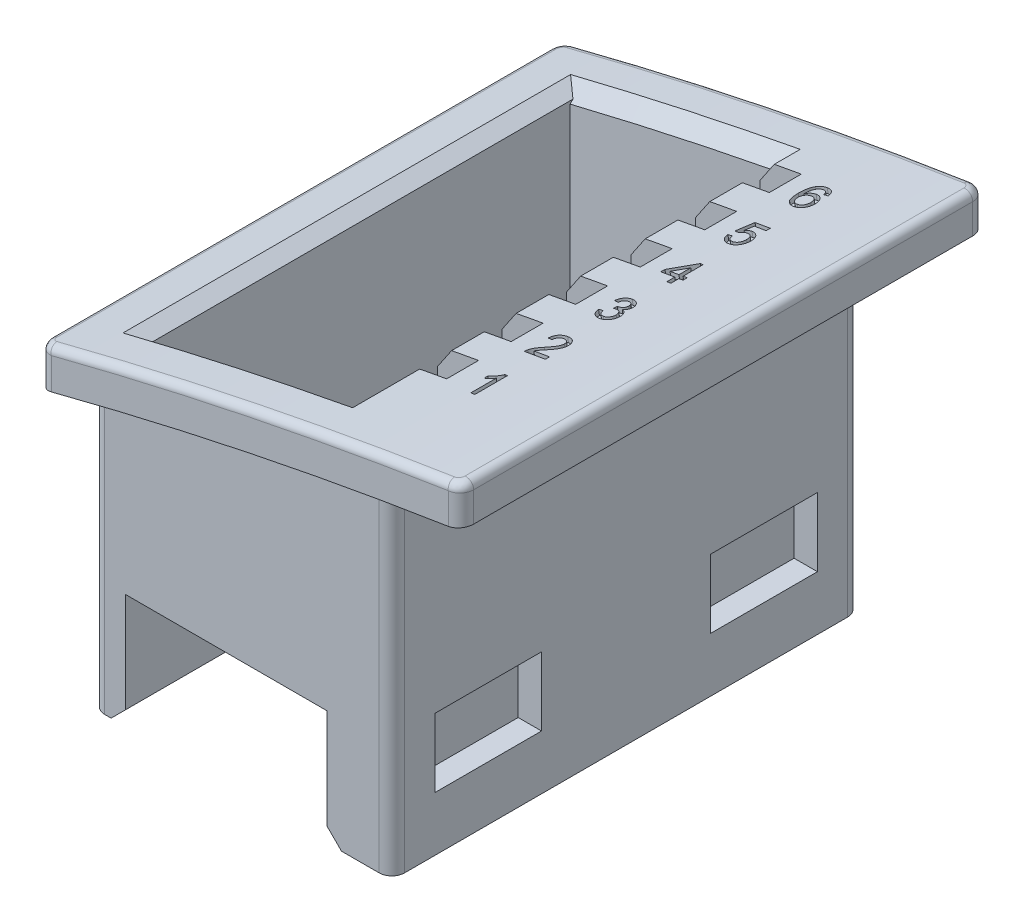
SolidWorks part; units mm, degrees
ref_plane "Front Plane" through (0, 0, 0) normal (0, 0, 1) x (1, 0, 0)
ref_plane "Top Plane" through (0, 0, 0) normal (0, 1, 0) x (1, 0, 0)
ref_plane "Right Plane" through (0, 0, 0) normal (1, 0, 0) x (0, 0, -1)
sketch "Sketch1" plane through (0, 0, 0) normal (0, 0, 1) x (1, 0, 0)
  line L0 (9.7211, 14.3502) -> (9.7193, 15.867)
  line L1 (-6.9049, 10.9118) -> (-6.9049, 12.4622)
  line L2 (6.8, 0) -> (-6.8, 0) construction
  line L3 (1.3625, 12.8514) -> (1.3625, 14.3829) construction
  arc A0 (9.7211, 14.3502) -> (-6.9049, 10.9118) centre (33.7964, -143.9799) ccw
  arc A3 (9.7193, 15.867) -> (-6.9049, 12.4622) centre (33.7964, -143.9799) ccw
  dimension "D1" = 160.15
  dimension "D3" = 161.65
  dimension "D2" = 12.8514
  dimension "D4" = 1.5168
  dimension "D5" = 1.5504
  dimension "D6" = 1.3625
extrude "Extrude1" add sketch "Sketch1" along normal mid plane 20.64
sketch "Sketch2" plane through (0, 0, 0) normal (0, 1, 0) x (1, 0, 0)
  line L0 (-5.9, -9.22) -> (5.9, -9.22)
  line L1 (5.9, 9.22) -> (5.9, -9.22)
  line L2 (5.9, 9.22) -> (-5.9, 9.22)
  line L3 (-5.9, 9.22) -> (-5.9, -9.22)
  line L4 (-5.9, 0) -> (5.9, 0) construction
  dimension "D1" = 11.8
  dimension "D2" = 18.44
extrude "Extrude2" add sketch "Sketch2" along normal up to surface (13.7218 mm away)
sketch "Sketch3" plane through (0, 0, 9.22) normal (0, 0, 1) x (1, 0, 0)
  line L0 (-5.9, 10.9118) -> (-6.9049, 10.9118)
  line L1 (-5.9, 11.1724) -> (-5.9, 0) construction
  line L2 (-5.9, 10.9118) -> (-5.9, 11.3118)
  line L3 (-5.9, 11.3118) -> (-6.9049, 10.9118)
  dimension "D1" = 0.4
extrude "Extrude4" add sketch "Sketch3" against normal up to surface (18.44 mm away)
sketch "Sketch4" plane through (0, 0, 0) normal (0, -1, 0) x (1, 0, 0)
  line L0 (3.35, -8.2785) -> (-4.5827, -8.2785)
  line L1 (3.35, -8.2785) -> (3.35, 8.2027)
  line L2 (3.35, 8.2027) -> (-4.5827, 8.2027)
  line L3 (-4.5827, -8.2785) -> (-4.5827, 8.2027)
  line L4 (-5.9, -9.22) -> (-5.9, 9.22) construction
  line L5 (-5.9, 9.22) -> (5.9, 9.22) construction
  dimension "D1" = 7.9327
  dimension "D2" = 16.4812
  dimension "D3" = 1.3173
  dimension "D4" = 1.0173
extrude "Cut-Extrude1" cut sketch "Sketch4" against normal up to surface (13.048 mm away)
fillet "Fillet1" radius 0.5 4 edges at (5.9, 6.8609, -9.22) (-5.9, 5.4559, -9.22) (-5.9, 5.4559, 9.22) (5.9, 6.8609, 9.22)
fillet "Fillet2" radius 0.5 4 edges at (9.7202, 15.1086, -10.32) (-6.9049, 11.687, -10.32) (-6.9049, 11.687, 10.32) (9.7202, 15.1086, 10.32)
fillet "Fillet3" radius 0.3 8 edges at (9.5344, 15.839, 10.2083) (9.7193, 15.867, 0) (9.6119, 15.8508, -10.1298) (1.3678, 14.384, -10.32) (-6.7251, 12.5089, -10.204) (-6.9049, 12.4622, 0) (-6.8013, 12.4891, 10.1248) (1.3678, 14.384, 10.32)
chamfer "Chamfer1" distance 0.5673 angle 45 4 edges at (-4.5827, 13.048, -0.0379) (-0.6272, 13.9623, 8.2027) (3.35, 14.777, -0.0379) (-0.6272, 13.9623, -8.2785)
sketch "Sketch5" plane through (0, 0, 9.22) normal (0, 0, -1) x (-1, 0, 0)
  line L0 (4.5827, 12.464) -> (4.5827, 0) construction
  line L1 (-3.35, 4.5) -> (4.5827, 4.5)
  line L2 (4.5827, 4.5) -> (4.5827, 0)
  line L4 (-5.4, 0) -> (5.4, 0) construction
  line L5 (4.5827, 0) -> (-3.35, 0)
  line L6 (-3.35, 14.0623) -> (-3.35, 0) construction
  line L7 (-3.35, 4.5) -> (-3.35, 0)
  dimension "D1" = 4.5
extrude "Cut-Extrude2" cut sketch "Sketch5" against normal up to surface (17.4985 mm away)
sketch "Sketch6" plane through (-5.9, 0, 0) normal (-1, 0, 0) x (0, 0, 1)
  line L0 (-2.9, 4.8417) -> (2.9, 4.8417)
  line L1 (-2.9, 2.1416) -> (-2.9, 4.8417)
  line L2 (-2.9, 2.1416) -> (2.9, 2.1416)
  line L3 (2.9, 4.8417) -> (2.9, 2.1416)
  line L4 (0, 2.1416) -> (0, 0) construction
  line L7 (-8.72, 0) -> (8.72, 0) construction
  dimension "D1" = 2.1416
  dimension "D2" = 5.8
  dimension "D3" = 2.7001
extrude "Cut-Extrude3" cut sketch "Sketch6" against normal blind 0.9687
sketch "Sketch7" plane through (5.9, 0, 0) normal (1, 0, 0) x (0, 0, -1)
  line L0 (7.5294, 4.8422) -> (7.5294, 2.1421)
  line L1 (3.3294, 4.8422) -> (7.5294, 4.8422)
  line L2 (3.3294, 2.1421) -> (7.5294, 2.1421)
  line L3 (3.3294, 2.1421) -> (3.3294, 4.8422)
  line L4 (7.5294, 3.4921) -> (9.22, 3.4921) construction
  line L5 (5.4294, 2.1421) -> (5.4294, 0) construction
  line L6 (0, 0) -> (0, 13.7218) construction
  line L7 (-8.72, 0) -> (8.72, 0) construction
  line L8 (9.22, 13.6325) -> (9.22, 0) construction
  line L9 (-8.72, 13.7218) -> (8.72, 13.7218) construction
  line L10 (-5.4294, 2.1421) -> (-5.4294, 0) construction
  line L11 (-7.5294, 3.4921) -> (-9.22, 3.4921) construction
  line L12 (-3.3294, 2.1421) -> (-3.3294, 4.8422)
  line L13 (-3.3294, 2.1421) -> (-7.5294, 2.1421)
  line L14 (-3.3294, 4.8422) -> (-7.5294, 4.8422)
  line L15 (-7.5294, 4.8422) -> (-7.5294, 2.1421)
  dimension "D1" = 4.2
  dimension "D2" = 2.7001
  dimension "D3" = 2.1421
  dimension "D4" = 1.6906
extrude "Cut-Extrude4" cut sketch "Sketch7" against normal blind 0.9187
sketch "Sketch8" plane through (0, 0, 0) normal (0, -1, 0) x (1, 0, 0)
  line L0 (4.6814, 6.1314) -> (3.35, 6.1314)
  line L1 (3.35, 4.8752) -> (4.6814, 4.8752)
  line L2 (4.6814, 6.1314) -> (4.6814, 4.8752)
  line L3 (-5.4, 9.22) -> (-4.5827, 9.22) construction
  line L4 (5.9, 8.72) -> (5.9, -8.72) construction
  line L5 (4.6814, 6.1314) -> (4.6814, 9.22) construction
  line L6 (4.6814, 5.5033) -> (5.9, 5.5033) construction
  line L7 (3.35, 6.1314) -> (3.35, 4.8752)
  line L8 (3.35, -8.2785) -> (3.35, 9.22) construction
  dimension "D1" = 1.2186
  dimension "D2" = 3.0886
  dimension "D3" = 1.2562
chamfer "Chamfer2" distance 0.5673 angle 45 3 edges at (3.35, 0, 0.4707) (-4.5827, 0, 0.4707) (-0.6164, 0, -8.2785)
extrude "Cut-Extrude6" cut sketch "Sketch8" against normal up to surface (15.0265 mm away)
pattern_linear "LPattern1" count 6 spacing 2.54 along (0, 0, -1) of "Cut-Extrude6"
sketch "Sketch9" plane through (0, 0, 10.32) normal (0, 0, 1) x (1, 0, 0)
  arc A0 (-6.4049, 12.5914) -> (9.2194, 15.7909) centre (33.7964, -143.9799) ccw construction
  point P0 (7.0615, 15.444)
ref_plane "Plane1" through (7.0615, 15.444, 10.02) normal (-0.1654, 0.9862, 0) x (-0.9862, -0.1654, 0)
sketch "Sketch10"
extrude "Cut-Extrude7" cut sketch "Sketch10" against normal blind 0.2
chamfer "Chamfer3" distance 0.2904 angle 45 6 edges at (4.6814, 15.0265, 5.5033) (4.6814, 15.0265, 2.9633) (4.6814, 15.0265, 0.4233) (4.6814, 15.0265, -2.1167) (4.6814, 15.0265, -4.6567) (4.6814, 15.0265, -7.1967)
